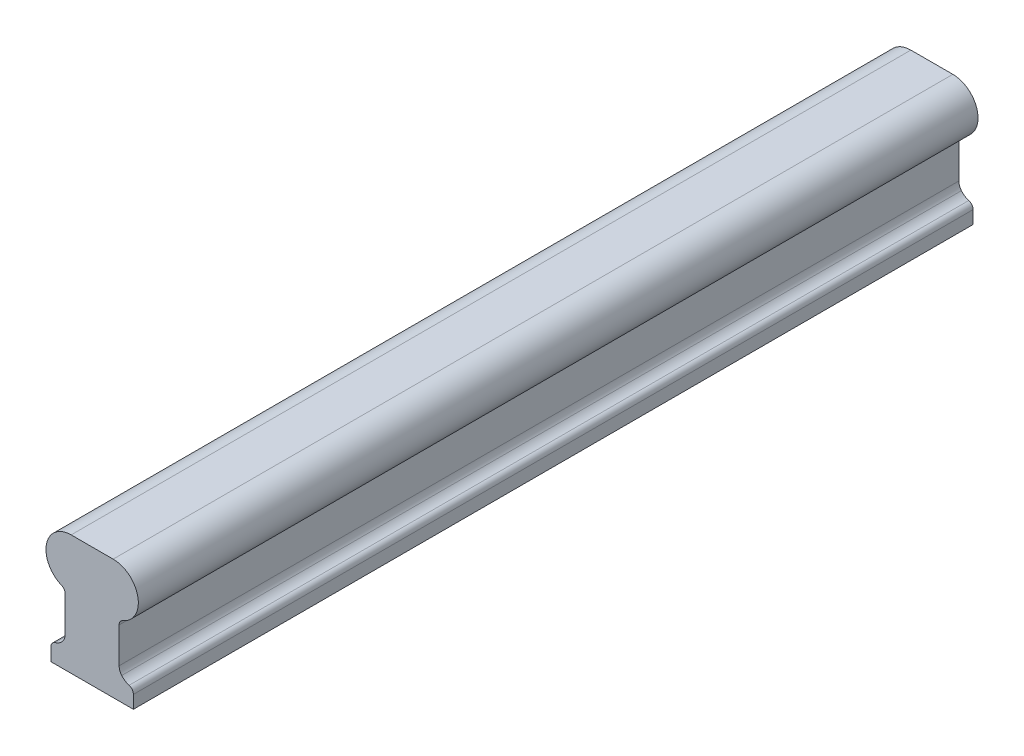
SolidWorks part; units mm, degrees
ref_plane "Front" through (0, 0, 0) normal (0, 0, 1) x (1, 0, 0)
ref_plane "Top" through (0, 0, 0) normal (0, 1, 0) x (1, 0, 0)
ref_plane "Right" through (0, 0, 0) normal (1, 0, 0) x (0, 0, -1)
sketch "Sketch1" plane through (0, 0, 0) normal (0, 0, 1) x (1, 0, 0)
  line L0 (17.4625, 0) -> (17.4625, 57.9454) construction
  line L1 (0, 0) -> (34.925, 0)
  line L2 (6.0325, 27.94) -> (6.0325, 12.9561)
  line L3 (8.5725, 50.8) -> (26.3525, 50.8)
  line L4 (28.8925, 27.94) -> (28.8925, 12.9561)
  line L5 (0, 0) -> (0, 5.4701)
  line L6 (34.925, 0) -> (34.925, 5.4701)
  arc A0 (8.5725, 50.8) -> (4.4694, 30.2846) centre (8.5725, 40.132) ccw
  arc A1 (26.3525, 50.8) -> (30.4556, 30.2846) centre (26.3525, 40.132) cw
  arc A2 (6.0325, 12.9561) -> (4.9372, 9.9462) centre (1.3493, 12.9561) cw
  arc A3 (28.8925, 12.9561) -> (29.9878, 9.9462) centre (33.5757, 12.9561) ccw
  arc A4 (1.8219, 7.9065) -> (4.9372, 9.9462) centre (0, 14.088) ccw
  arc A5 (33.1031, 7.9065) -> (29.9878, 9.9462) centre (34.925, 14.088) cw
  arc A6 (33.1031, 7.9065) -> (34.925, 5.4701) centre (32.385, 5.4701) cw
  arc A7 (0, 5.4701) -> (1.8219, 7.9065) centre (2.54, 5.4701) cw
  arc A8 (28.8925, 27.94) -> (30.4556, 30.2846) centre (31.4325, 27.94) cw
  arc A9 (4.4694, 30.2846) -> (6.0325, 27.94) centre (3.4925, 27.94) cw
  point P29 (0, 0)
  point P30 (0, 0)
  dimension "D1" = 2.54
  dimension "D2" = 2.54
  dimension "D6" = 10.668
  dimension "D7" = 10.668
  dimension "D3" = 22.86
  dimension "D4" = 50.8
  dimension "D5" = 17.78
  dimension "D8" = 34.925
  dimension "D9" = 27.94
extrude "Base-Extrude" add sketch "Sketch1" along normal blind 355.6
